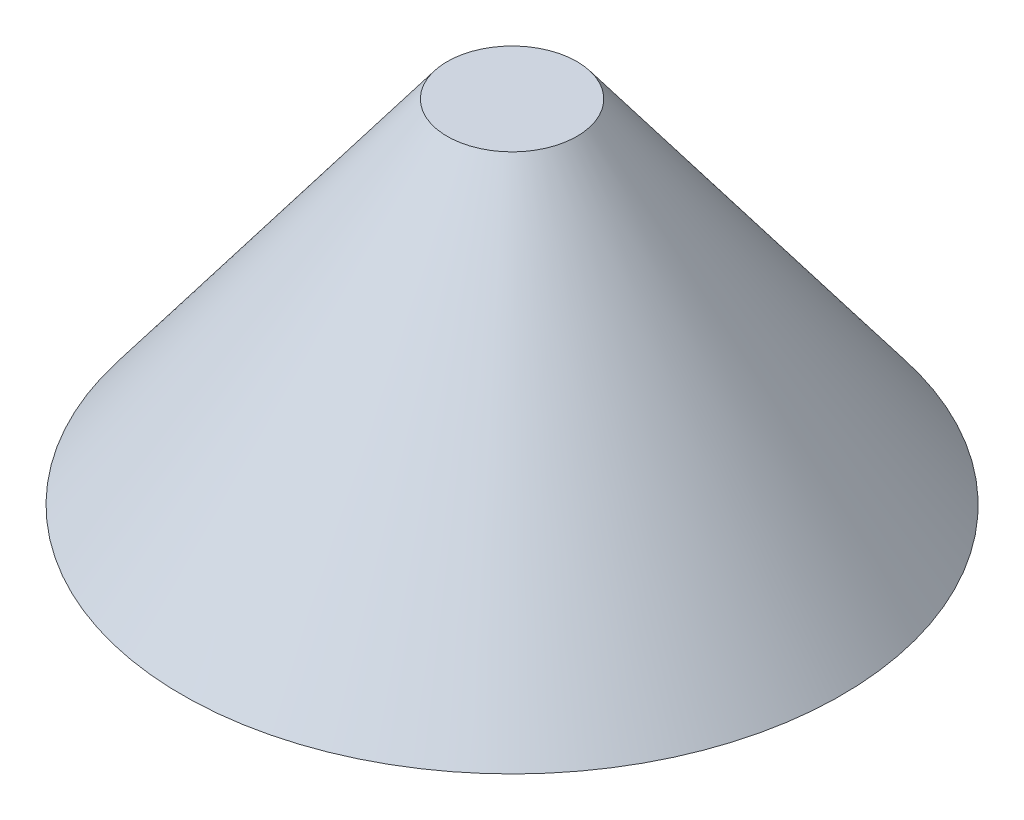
SolidWorks part; units mm, degrees
ref_plane "Front Plane" through (0, 0, 0) normal (0, 0, 1) x (1, 0, 0)
ref_plane "Top Plane" through (0, 0, 0) normal (0, 1, 0) x (1, 0, 0)
ref_plane "Right Plane" through (0, 0, 0) normal (1, 0, 0) x (0, 0, -1)
sketch "Sketch1" plane through (0, 0, 0) normal (0, 0, 1) x (1, 0, 0)
  line L0 (0, 0) -> (95.3484, 0)
  line L1 (95.3484, 0) -> (18.767, 101.7074)
  line L2 (18.767, 101.7074) -> (0, 101.7074)
  line L3 (0, 101.7074) -> (0, 0)
revolve "Revolve1" add sketch "Sketch1" angle 360 about L3
sketch "Sketch2" plane through (0, 0, 0) normal (0, 0, 1) x (1, 0, 0)
  point P0 (50.3963, 59.1305)
